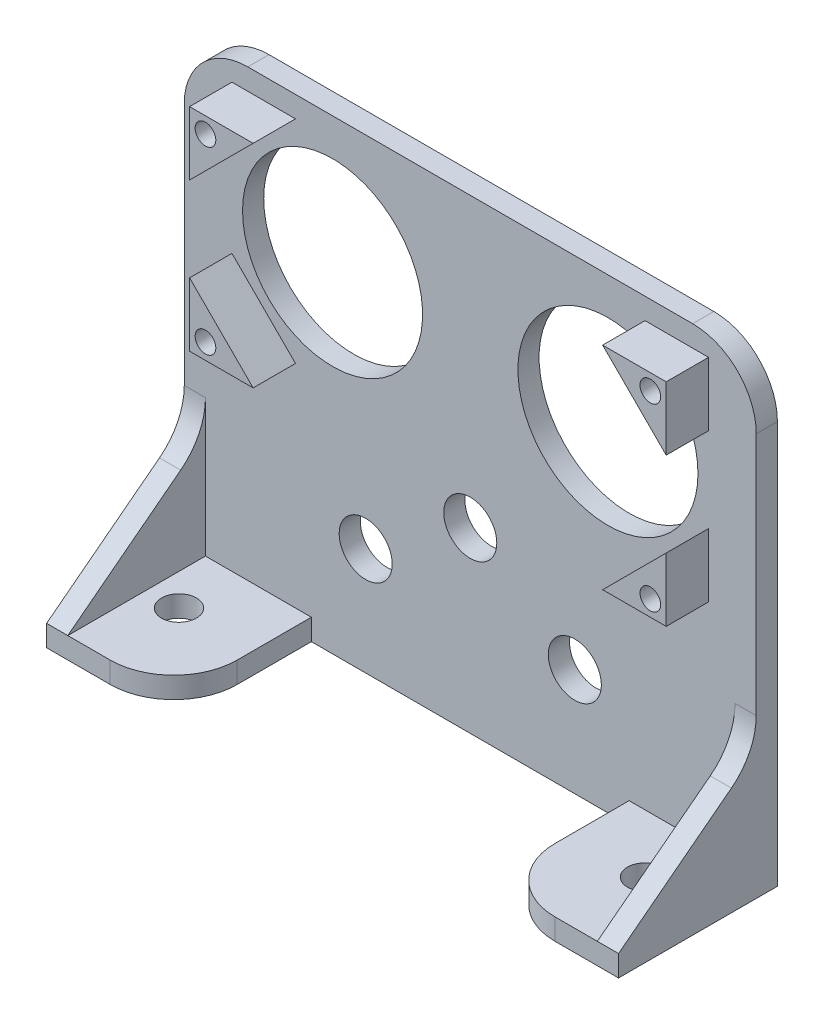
SolidWorks part; units mm, degrees
ref_plane "Front Plane" through (0, 0, 0) normal (0, 0, 1) x (1, 0, 0)
ref_plane "Top Plane" through (0, 0, 0) normal (0, 1, 0) x (1, 0, 0)
ref_plane "Right Plane" through (0, 0, 0) normal (1, 0, 0) x (0, 0, -1)
sketch "Sketch1" plane through (0, 0, 0) normal (0, 0, 1) x (1, 0, 0)
  line L0 (-27, 0) -> (27, 0)
  line L2 (27, 0) -> (27, 44)
  line L3 (27, 44) -> (-27, 44)
  line L4 (-27, 0) -> (-27, 44)
  line L5 (0, 0) -> (-27, 44) construction
  line L6 (27, 44) -> (0, 0) construction
  line L7 (-27, 32) -> (27, 32) construction
  line L8 (0, 0) -> (0, 44) construction
  circle A0 centre (13, 32) radius 8.5
  circle A1 centre (-13, 32) radius 8.5
  circle A2 centre (0, 16.8131) radius 2.505
  circle A3 centre (9.8734, 10.148) radius 2.505
  circle A4 centre (-9.8734, 10.148) radius 2.505
  point P0 (0, 0)
  dimension "D4" = 17
  dimension "D5" = 26
  dimension "D6" = 5.01
  dimension "D7" = 5.01
  dimension "D1" = 54
  dimension "D2" = 44
  dimension "D3" = 12
extrude "Boss-Extrude1" add sketch "Sketch1" along normal blind 2
sketch "Sketch6" plane through (0, 0, 2) normal (0, 0, 1) x (1, 0, 0)
  line L0 (-21.5, 32) -> (21.5, 32) construction
  line L1 (-27, 44) -> (-27, 0) construction
  line L2 (-22.5, 42) -> (22.5, 42)
  line L3 (-22.5, 42) -> (-22.5, 22)
  line L4 (-22.5, 22) -> (22.5, 22)
  line L5 (22.5, 42) -> (22.5, 22)
  line L6 (-22.5, 42) -> (22.5, 22) construction
  line L7 (-22.5, 22) -> (22.5, 42) construction
  line L8 (27, 44) -> (-27, 44) construction
  line L9 (27, 0) -> (27, 44) construction
  line L10 (-27, 44) -> (-27, 0)
  line L11 (27, 44) -> (-27, 44)
  line L12 (27, 0) -> (27, 44)
  line L13 (-27, 0) -> (27, 0)
  circle A0 centre (-13, 32) radius 8.5 construction
  circle A1 centre (13, 32) radius 8.5 construction
  circle A2 centre (9.8734, 10.148) radius 2.505 construction
  circle A3 centre (0, 16.8131) radius 2.505 construction
  circle A4 centre (-9.8734, 10.148) radius 2.505 construction
  circle A5 centre (9.8734, 10.148) radius 2.505
  circle A6 centre (0, 16.8131) radius 2.505
  circle A7 centre (-9.8734, 10.148) radius 2.505
  point P7 (0, 32)
  dimension "D1" = 20
  dimension "D2" = 45
sketch "Sketch8" plane through (0, 0, 0) normal (0, -1, 0) x (1, 0, 0)
  line L0 (27, 2) -> (27, 0) construction
  line L1 (-27, 0) -> (27, 0)
  line L2 (-27, 0) -> (-27, 15)
  line L3 (-27, 15) -> (27, 15)
  line L4 (27, 0) -> (27, 15)
  line L5 (0, 2) -> (0, 15) construction
  line L6 (22, 0) -> (22, 15) construction
  line L7 (0, 7.5) -> (27, 7.5) construction
  line L9 (-27, 2) -> (27, 2) construction
  circle A0 centre (22, 7.5) radius 1.65
  circle A1 centre (-22, 7.5) radius 1.65
  dimension "D2" = 3.3
  dimension "D1" = 15
  dimension "D3" = 5
  dimension "D4" = 7.5
extrude "Boss-Extrude5" add sketch "Sketch8" against normal blind 2
sketch "Sketch12" plane through (-27, 0, 0) normal (-1, 0, 0) x (0, 0, 1)
  line L7 (15, 2) -> (2, 12)
  line L8 (2, 44) -> (2, 2) construction
  line L9 (2, 12) -> (0, 12)
  line L10 (0, 44) -> (0, 0) construction
  line L11 (0, 12) -> (0, 0)
  line L12 (0, 0) -> (15, 0)
  line L13 (15, 0) -> (15, 2)
extrude "Boss-Extrude7" add sketch "Sketch12" against normal blind 2
mirror "Mirror1" about plane through (0, 0, 0) normal (1, 0, 0) of "Boss-Extrude7"
fillet "Fillet9" radius 6 4 edges at (26, 12, 2) (-26, 12, 2) (27, 44, 1) (-27, 44, 1)
sketch "Sketch13" plane through (0, 0, 2) normal (0, 0, 1) x (1, 0, 0)
  line L0 (-21.5, 32) -> (21.5, 32) construction
  line L1 (-22.5, 42) -> (-19.2832, 38.7832) construction
  line L2 (-22.5, 42) -> (-16.5, 42)
  line L3 (-22.5, 42) -> (-22.5, 36)
  line L4 (-22.5, 22) -> (-16.5, 22)
  line L5 (22.5, 42) -> (22.5, 36)
  line L6 (-22.5, 42) -> (22.5, 22) construction
  line L7 (-22.5, 22) -> (22.5, 42) construction
  line L8 (0, -1.1) -> (0, 1.1) construction
  line L9 (-22.5, 36) -> (-16.5, 42)
  line L10 (-22.5, 28) -> (-16.5, 22)
  line L11 (22.5, 28) -> (16.5, 22)
  line L12 (22.5, 36) -> (16.5, 42)
  line L13 (16.5, 42) -> (22.5, 42)
  line L14 (-22.5, 28) -> (-22.5, 22)
  line L15 (16.5, 22) -> (22.5, 22)
  line L16 (22.5, 28) -> (22.5, 22)
  circle A0 centre (-13, 32) radius 8.5 construction
  circle A1 centre (13, 32) radius 8.5 construction
  point P7 (0, 32)
  dimension "D1" = 45
  dimension "D2" = 20
extrude "Boss-Extrude8" add sketch "Sketch13" along normal blind 4
sketch "Sketch15" plane through (0, 0, 0) normal (0, -1, 0) x (1, 0, 0)
  line L0 (-27, 0) -> (27, 0) construction
  line L1 (27, 6) -> (-27, 6) construction
  line L2 (27, 15) -> (27, 0) construction
  line L3 (0, 0) -> (0, 15) construction
  line L4 (-27, 15) -> (-27, 0) construction
  line L5 (27, 15) -> (-27, 15) construction
  circle A0 centre (7, 6) radius 2.5
  circle A1 centre (-7, 6) radius 2.5
  dimension "D2" = 5
  dimension "D1" = 7
  dimension "D3" = 6
extrude "Cut-Extrude1" cut sketch "Sketch15" against normal mid plane 4
sketch "Sketch16" plane through (0, 0, 6) normal (0, 0, 1) x (1, 0, 0)
  circle A4 centre (21, 23.5) radius 0.975
  circle A5 centre (21, 40.5) radius 0.975
  circle A6 centre (-21, 40.5) radius 0.975
  circle A7 centre (-21, 23.5) radius 0.975
extrude "Cut-Extrude2" cut sketch "Sketch16" against normal through all and the other way through all
sketch "Sketch17" plane through (0, 2, 0) normal (0, 1, 0) x (1, 0, 0)
  line L5 (0, 0) -> (0, -16.887) construction
  line L7 (-15, -15) -> (15, -15)
  line L8 (25, -15) -> (-25, -15) construction
  line L9 (15, -15) -> (15, -2)
  line L10 (21, -2) -> (-21, -2) construction
  line L11 (15, -2) -> (-15, -2)
  line L12 (-15, -15) -> (-15, -2)
  point P12 (0, -2)
  point P13 (0, -15)
  dimension "D1" = 15
extrude "Cut-Extrude4" cut sketch "Sketch17" against normal blind 10
fillet "Fillet10" radius 6 2 edges at (15, 1, 15) (-15, 1, 15)
